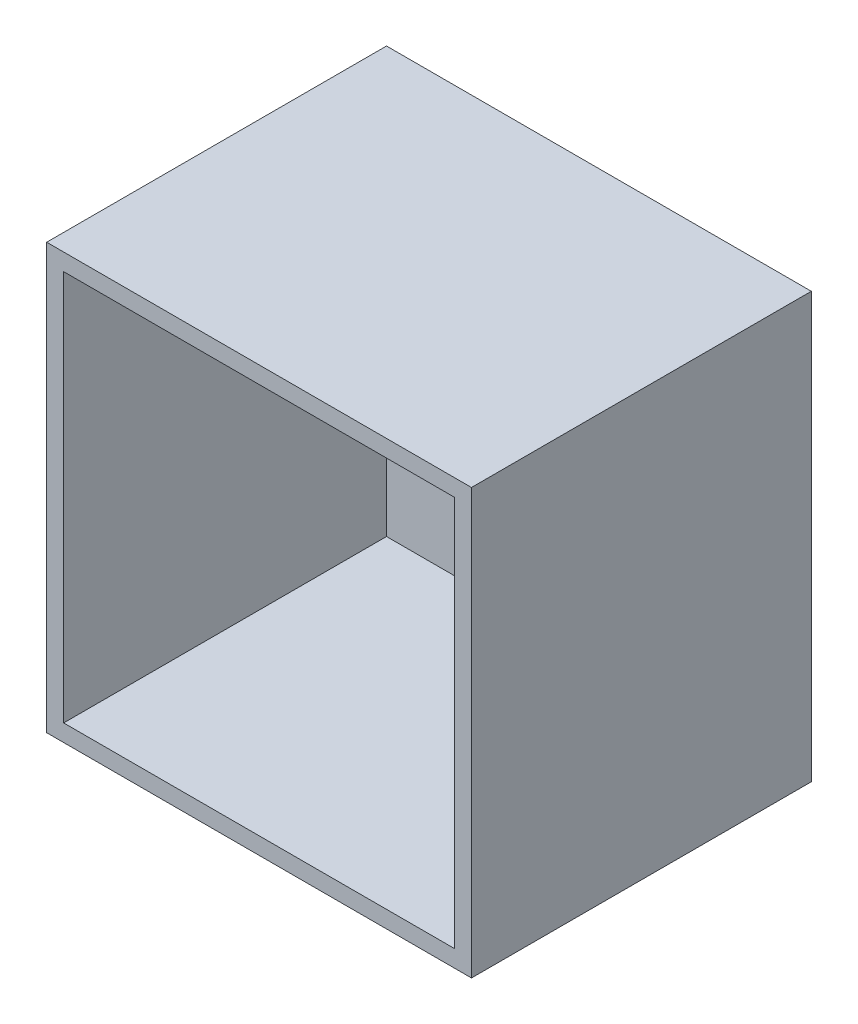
SolidWorks part; units mm, degrees
ref_plane "Płaszczyzna przednia" through (0, 0, 0) normal (0, 0, 1) x (1, 0, 0)
ref_plane "Płaszczyzna górna" through (0, 0, 0) normal (0, 1, 0) x (1, 0, 0)
ref_plane "Płaszczyzna prawa" through (0, 0, 0) normal (1, 0, 0) x (0, 0, -1)
sketch "Szkic1" plane through (0, 0, 0) normal (0, 0, 1) x (1, 0, 0)
  line L1 (25, -25) -> (-25, -25)
  line L2 (25, -25) -> (25, 25)
  line L3 (25, 25) -> (-25, 25)
  line L4 (-25, -25) -> (-25, 25)
  line L5 (25, -25) -> (-25, 25) construction
  line L6 (25, 25) -> (-25, -25) construction
  point P0 (0, 0)
  dimension "D1" = 50
  dimension "D2" = 50
extrude "Dodanie-wyciągnięcie1" add sketch "Szkic1" along normal blind 40
shell "Skorupa1" thickness 2
